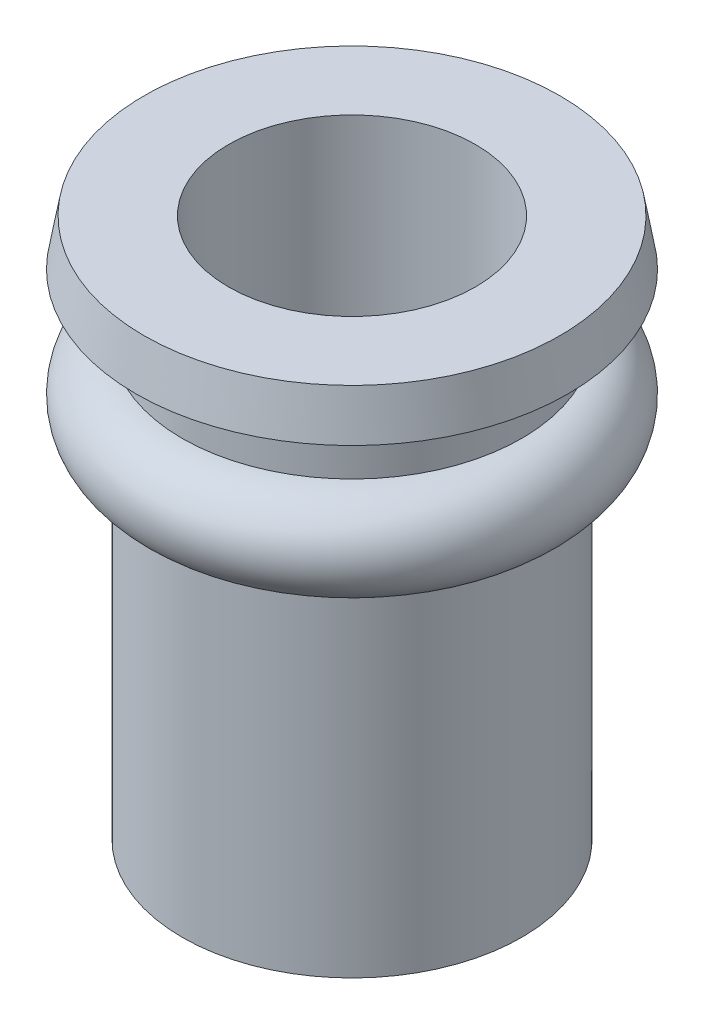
SolidWorks part; units mm, degrees
ref_plane "Vorne" through (0, 0, 0) normal (0, 0, 1) x (1, 0, 0)
ref_plane "Oben" through (0, 0, 0) normal (0, 1, 0) x (1, 0, 0)
ref_plane "Rechts" through (0, 0, 0) normal (1, 0, 0) x (0, 0, -1)
sketch "Skizze1" plane through (0, 0, 0) normal (0, 0, 1) x (1, 0, 0)
  line L0 (0, 38.9535) -> (0, -37.5523) construction
  line L1 (6.7355, 17.5) -> (0, 17.5)
  line L2 (5.5, 0) -> (5.5, 11)
  line L3 (5.5, 14) -> (5.5, 16)
  line L4 (5.5, 16) -> (7, 16)
  line L5 (7, 16) -> (6.7355, 17.5)
  line L6 (5.5, 0) -> (0, 0)
  line L7 (0, 17.5) -> (0, 0)
  arc A0 (5.5, 14) -> (5.5, 11) centre (5.5, 12.5) cw
  dimension "D2" = 1.5
  dimension "D1" = 10
  dimension "D3" = 1.5
  dimension "D4" = 5.5
  dimension "D5" = 7
  dimension "D6" = 3.5
  dimension "D7" = 17.5
revolve "Basis-Rotation" add sketch "Skizze1" angle 360 about L0
sketch "Skizze2" plane through (0, 0, 0) normal (0, -1, 0) x (1, 0, 0)
  circle A0 centre (0, 0) radius 4
  dimension "D1" = 8
extrude "Schnitt-Linear austragen2" cut sketch "Skizze2" against normal through all
